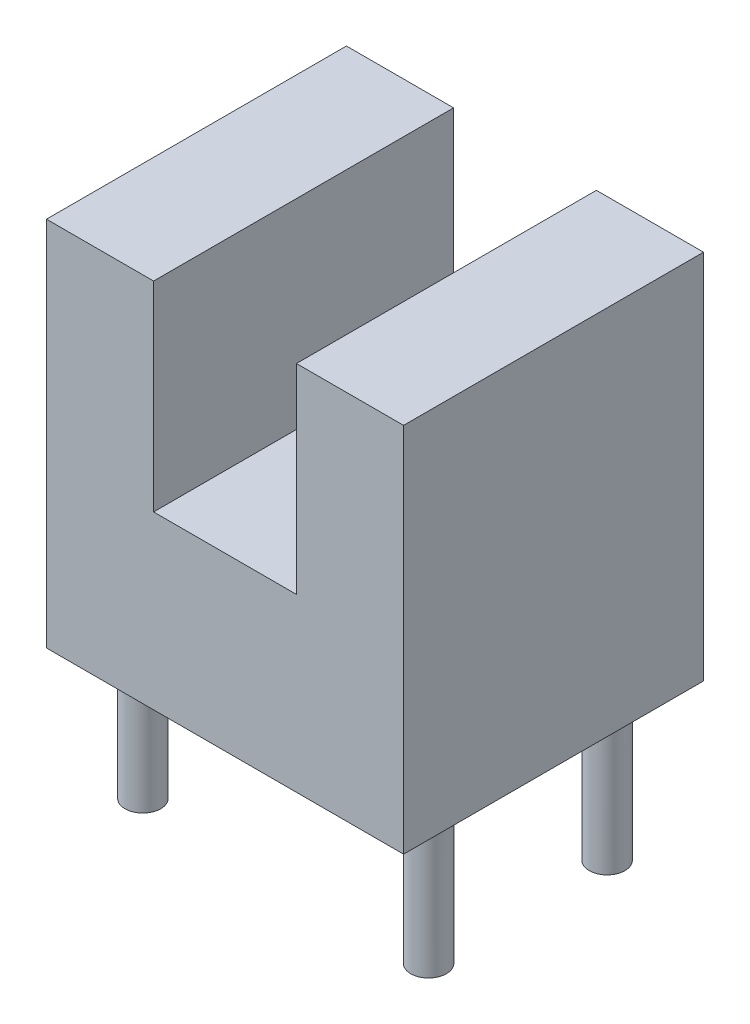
SolidWorks part; units mm, degrees
ref_plane "Front Plane" through (0, 0, 0) normal (0, 0, 1) x (1, 0, 0)
ref_plane "Top Plane" through (0, 0, 0) normal (0, 1, 0) x (1, 0, 0)
ref_plane "Right Plane" through (0, 0, 0) normal (1, 0, 0) x (0, 0, -1)
sketch "Sketch1" plane through (0, 0, 0) normal (0, 0, 1) x (1, 0, 0)
  line L0 (1, 5.2) -> (2.5, 5.2)
  line L1 (-2.5, 0) -> (2.5, 0)
  line L2 (-2.5, 0) -> (-2.5, 5.2)
  line L3 (-2.5, 5.2) -> (-1, 5.2)
  line L4 (2.5, 0) -> (2.5, 5.2)
  line L6 (1, 5.2) -> (1, 2.4)
  line L7 (1, 2.4) -> (-1, 2.4)
  line L8 (-1, 5.2) -> (-1, 2.4)
  point P8 (3.573, 9.9355)
  point P9 (1.2159, 2.4)
  point P10 (0, 0)
  point P12 (1, 6.013)
  dimension "D1" = 2
  dimension "D2" = 2.8
  dimension "D3" = 5.2
  dimension "D4" = 5
extrude "Boss-Extrude1" add sketch "Sketch1" along normal blind 4.2
sketch "Sketch2" plane through (0, 0, 0) normal (0, -1, 0) x (1, 0, 0)
  line L0 (2.5, 4.2) -> (2.5, 0) construction
  line L1 (2, 3.35) -> (-2, 3.35) construction
  line L2 (2, 3.35) -> (2, 0.85) construction
  line L3 (2, 0.85) -> (-2, 0.85) construction
  line L4 (-2, 3.35) -> (-2, 0.85) construction
  line L5 (-2.5, 4.2) -> (2.5, 4.2) construction
  circle A0 centre (-2, 3.35) radius 0.25
  circle A1 centre (2, 3.35) radius 0.25
  circle A2 centre (2, 0.85) radius 0.25
  circle A3 centre (-2, 0.85) radius 0.25
  point P4 (2, 2.1)
  point P7 (2.5, 2.1)
  point P10 (0, 4.2)
  point P11 (0, 3.35)
  dimension "D3" = 0.5
  dimension "D1" = 2.5
  dimension "D2" = 4
extrude "Boss-Extrude2" add sketch "Sketch2" along normal blind 2
